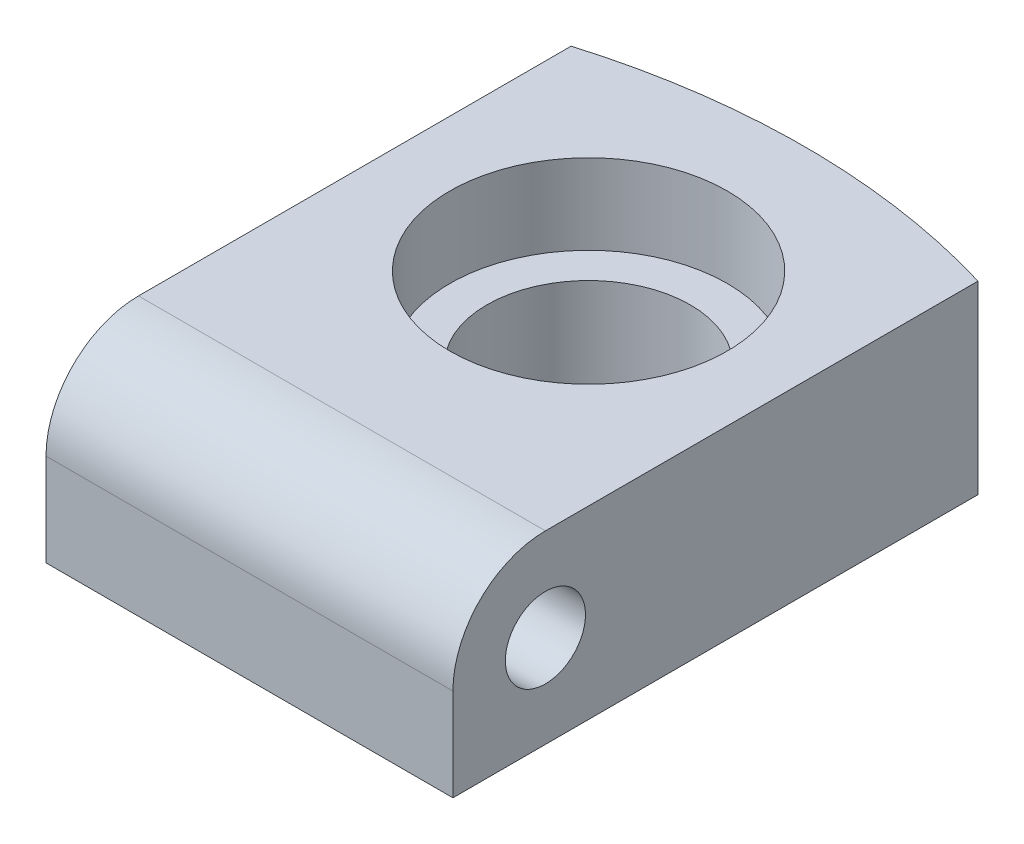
SolidWorks part; units mm, degrees
ref_plane "Front Plane" through (0, 0, 0) normal (0, 0, 1) x (1, 0, 0)
ref_plane "Top Plane" through (0, 0, 0) normal (0, 1, 0) x (1, 0, 0)
ref_plane "Right Plane" through (0, 0, 0) normal (1, 0, 0) x (0, 0, -1)
sketch "Sketch1" plane through (0, 0, 0) normal (1, 0, 0) x (0, 0, -1)
  line L1 (0, 0) -> (-90, 0)
  line L2 (0, 0) -> (0, 30)
  line L3 (0, 30) -> (-75, 30)
  line L4 (-90, 0) -> (-90, 15)
  arc A0 (-75, 30) -> (-90, 15) centre (-75, 15) ccw
  dimension "D3" = 15
  dimension "D1" = 30
  dimension "D2" = 90
extrude "Boss-Extrude1" add sketch "Sketch1" against normal blind 66
hole_wizard "Ø13.0 (13) Diameter Hole1" positions "Sketch2" profile "Sketch4" hole size "Ø13.0" standard "ANSI Metric"
sketch "Sketch2" plane through (0, 0, 0) normal (1, 0, 0) x (0, 0, -1)
  point P0 (-75, 15)
sketch "Sketch4" plane through (0, 15, 75) normal (0, 1, 0) x (0, 0, -1)
  line L0 (0, 0) -> (0, 66)
  line L1 (0, 66) -> (6.5, 66)
  line L2 (6.5, 66) -> (6.5, 0)
  line L5 (6.5, 0) -> (0, 0)
  line L11 (0, -6.35) -> (0, 107.95) construction
  dimension "Thru Hole Dia." = 13
  dimension "Thru Hole Depth" = 66
hole_wizard "Hole1" positions "Sketch5" profile "Sketch6" legacy
sketch "Sketch5" plane through (0, 30, 0) normal (0, 1, 0) x (1, 0, 0)
  line L0 (-66, 0) -> (0, 0) construction
  point P0 (-33, -35)
  point P5 (0, 0)
  point P6 (-33, 0)
  dimension "D1" = 35
sketch "Sketch6" plane through (-33, 30, 35) normal (1, 0, 0) x (0, 0, 1)
  line L0 (0, 0) -> (0, 30)
  line L1 (0, 30) -> (16.5, 30)
  line L2 (16.5, 30) -> (16.5, 13)
  line L3 (16.5, 13) -> (22.5, 13)
  line L4 (22.5, 13) -> (22.5, 0)
  line L5 (22.5, 0) -> (0, 0)
  line L6 (0, 110) -> (0, -10) construction
  dimension "Diameter" = 33
  dimension "Depth" = 30
  dimension "C-Bore Diameter" = 45
  dimension "C-Bore Depth" = 13
sketch "Sketch8" plane through (0, 30, 0) normal (0, 1, 0) x (1, 0, 0)
  line L0 (-66, 0) -> (-66, -75) construction
  line L1 (0, 0) -> (0, -75) construction
  line L2 (-66, 0) -> (0, 0) construction
  line L3 (-66, -4.8365) -> (-66, 0)
  line L4 (-66, 0) -> (0, 0)
  line L5 (0, 0) -> (0, -4.8365)
  arc A0 (-66, -4.8365) -> (0, -4.8365) centre (-33, -115) cw
  point P9 (-33, 0)
  dimension "D1" = 115
extrude "Cut-Extrude1" cut sketch "Sketch8" against normal through all contours A0 L4 M4 | A0 M3 M2
